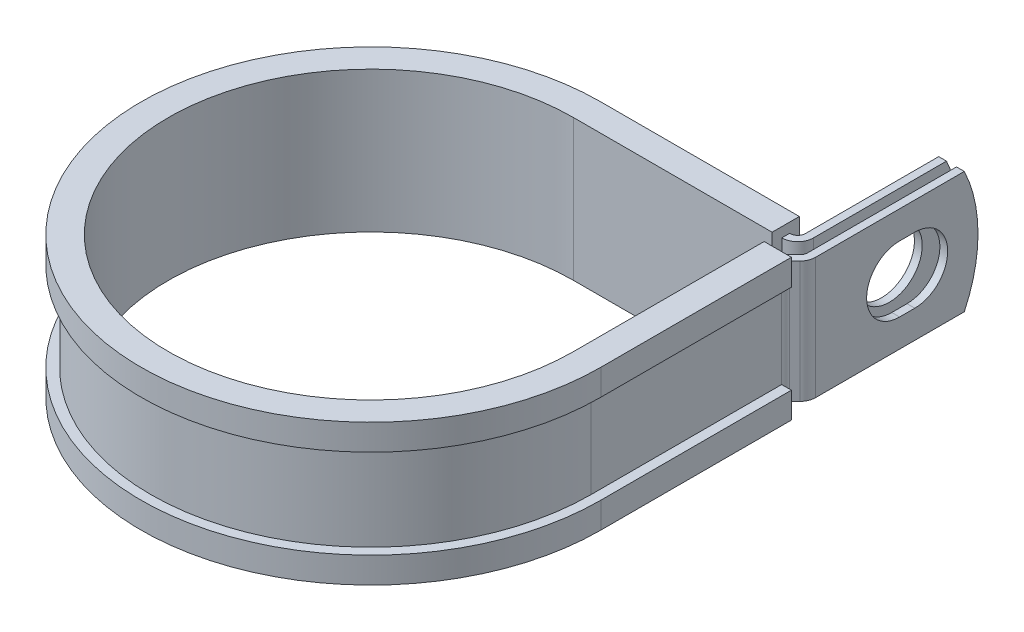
SolidWorks part; units mm, degrees
ref_plane "Front Plane" through (0, 0, 0) normal (0, 0, 1) x (1, 0, 0)
ref_plane "Top Plane" through (0, 0, 0) normal (0, 1, 0) x (1, 0, 0)
ref_plane "Right Plane" through (0, 0, 0) normal (1, 0, 0) x (0, 0, -1)
sketch "Sketch1" plane through (0, 0, 0) normal (0, 1, 0) x (1, 0, 0)
  line L0 (0, 33.274) -> (31.1583, 33.274)
  line L1 (33.274, 0) -> (33.274, 29.8615)
  line L2 (33.5967, 58.7248) -> (33.5967, 35.7124)
  line L3 (33.9882, 31.5857) -> (34.8144, 32.4119)
  line L5 (35.1715, 33.274) -> (35.1715, 58.7248)
  arc A0 (0, 33.274) -> (33.274, 0) centre (0, 0) ccw
  arc A1 (33.9882, 31.5857) -> (33.274, 29.8615) centre (35.7124, 29.8615) ccw
  arc A2 (34.8144, 32.4119) -> (35.1715, 33.274) centre (33.9523, 33.274) ccw
  arc A3 (31.1583, 33.274) -> (33.5967, 35.7124) centre (31.1583, 35.7124) ccw
extrude "Extrude-Thin1" add sketch "Sketch1" along normal mid plane 19.05 thin
sketch "Sketch2" plane through (32.3775, 0, 0) normal (-1, 0, 0) x (0, 0, 1)
  line L0 (-58.7248, 9.525) -> (-58.7248, -9.525) construction
  line L1 (0, 9.525) -> (0, -9.525) construction
  circle A0 centre (-47.625, 0) radius 5.1562
  point P2 (-58.7248, 0)
extrude "Cut-Extrude1" cut sketch "Sketch2" against normal up to surface (1.2192 mm away)
sketch "Sketch3" plane through (36.3907, 0, 0) normal (1, 0, 0) x (0, 0, -1)
  line L0 (46.4312, 0) -> (48.8188, 0) construction
  line L1 (46.4312, 5.1562) -> (48.8188, 5.1562)
  line L2 (46.4312, -5.1562) -> (48.8188, -5.1562)
  line L3 (58.7248, 9.525) -> (58.7248, -9.525) construction
  arc A0 (46.4312, 5.1562) -> (46.4312, -5.1562) centre (46.4312, 0) ccw
  arc A1 (48.8188, -5.1562) -> (48.8188, 5.1562) centre (48.8188, 0) ccw
  point P3 (47.625, 0)
  point P8 (58.7248, 0)
  point P11 (41.275, 0)
  point P12 (53.975, 0)
extrude "Cut-Extrude2" cut sketch "Sketch3" against normal up to surface (1.2192 mm away)
sketch "Sketch4" plane through (32.3775, 0, 0) normal (-1, 0, 0) x (0, 0, 1)
  line L0 (-58.7248, 9.525) -> (-58.7248, -9.525)
  line L1 (-58.7248, 9.525) -> (-56.5803, 9.525)
  line L2 (-58.7248, 9.525) -> (-35.7124, 9.525) construction
  line L3 (-58.7248, -9.525) -> (-56.5803, -9.525)
  line L4 (-58.7248, -9.525) -> (-35.7124, -9.525) construction
  arc A0 (-56.5803, 9.525) -> (-56.5803, -9.525) centre (-36.4998, 0) ccw
extrude "Cut-Extrude3" cut sketch "Sketch4" against normal through all contours A0 M4 M5 | A0 L0 M2
ref_plane "Plane1" through (0, 0, -29.8615) normal (0, 0, -1) x (-1, 0, 0)
ref_plane "Plane2" through (31.1075, 0, 0) normal (-1, 0, 0) x (0, 0, 1)
sketch "Sketch5" plane through (0, 0, -29.8615) normal (0, 0, -1) x (-1, 0, 0)
  line L0 (-34.4932, 9.525) -> (-33.274, 9.525)
  line L1 (-34.4932, 9.525) -> (-34.4932, -9.525) construction
  line L3 (-33.274, 9.525) -> (-33.274, -9.525)
  line L4 (-33.274, -9.525) -> (-34.4932, -9.525)
  line L5 (-34.4932, -9.525) -> (-34.4932, -6.985)
  line L6 (-34.4932, 9.525) -> (-34.4932, 6.985)
  line L7 (-36.0172, 11.049) -> (-36.0172, 6.985)
  line L8 (-36.0172, 11.049) -> (-31.75, 11.049)
  line L9 (-31.75, 11.049) -> (-31.75, -11.049)
  line L10 (-31.75, -11.049) -> (-36.0172, -11.049)
  line L11 (-36.0172, -11.049) -> (-36.0172, -6.985)
  line L12 (-36.0172, 6.985) -> (-34.4932, 6.985)
  line L13 (-34.4932, -6.985) -> (-36.0172, -6.985)
sketch "Sketch6" plane through (0, 9.525, 0) normal (0, 1, 0) x (1, 0, 0)
  line L0 (31.75, 0) -> (31.75, 29.8615)
  line L1 (31.75, 29.8615) -> (36.0172, 29.8615) construction
  line L2 (31.1075, 6.9878) -> (31.1075, -6.9878) construction
  line L5 (0, 31.75) -> (31.1075, 31.75)
  arc A0 (0, 31.75) -> (31.75, 0) centre (0, 0) ccw
sweep "Sweep1" add profiles "Sketch5" path "Sketch6"
equation "\"D4@Sketch5\" = \"D1@Extrude-Thin1\""
equation "\"D5@Sketch5\" = \"D5@Extrude-Thin1\""
equation "\"D1@Sketch3\" = \"D2@Sketch2\""
equation "\"D7@Sketch1\" = \"D3@Sketch2\" + \"D1@Sketch3\""
equation "\"D1@Sketch1\" = \"D1@Sketch6\" + 2 * \"D3@Sketch5\""
equation "\"D1@Sketch4\" = ( \"D1@Extrude-Thin1\" + .125 ) * 2"
equation "\"D9@Sketch1\"= \"D5@Extrude-Thin1\""
equation "\"D8@Sketch1\"= 2 * \"D5@Extrude-Thin1\""
equation "\"D2@Sketch1\" = 2 * \"D5@Extrude-Thin1\""
equation "\"D2@Sketch3\" = \"D1@Sketch2\""
